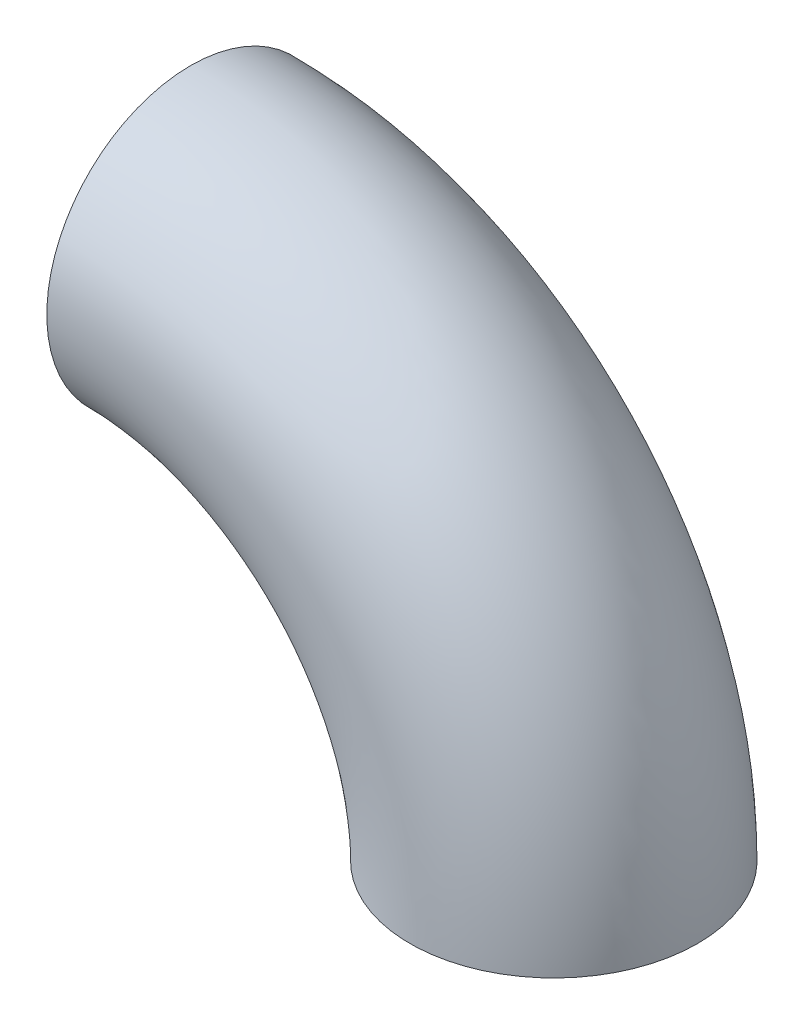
SolidWorks part; units mm, degrees
ref_plane "Front Plane" through (0, 0, 0) normal (0, 0, 1) x (1, 0, 0)
ref_plane "Top Plane" through (0, 0, 0) normal (0, 1, 0) x (1, 0, 0)
ref_plane "Right Plane" through (0, 0, 0) normal (1, 0, 0) x (0, 0, -1)
sketch "Sketch1" plane through (0, 0, 0) normal (0, 1, 0) x (1, 0, 0)
  circle A0 centre (0, 0) radius 26.2509
  circle A1 centre (0, 0) radius 30.1625
  dimension "D1" = 52.5018
  dimension "D2" = 60.325
sketch "Sketch2" plane through (0, 0, 0) normal (0, 0, 1) x (1, 0, 0)
  line L0 (0, -55) -> (0, 55) construction
  arc A0 (0, 0) -> (-76.2, 76.2) centre (-76.2, 0) ccw
  dimension "D1" = 76.2
  dimension "D2" = 76.2
sweep "Sweep1" add profiles "Sketch1" path "Sketch2"
